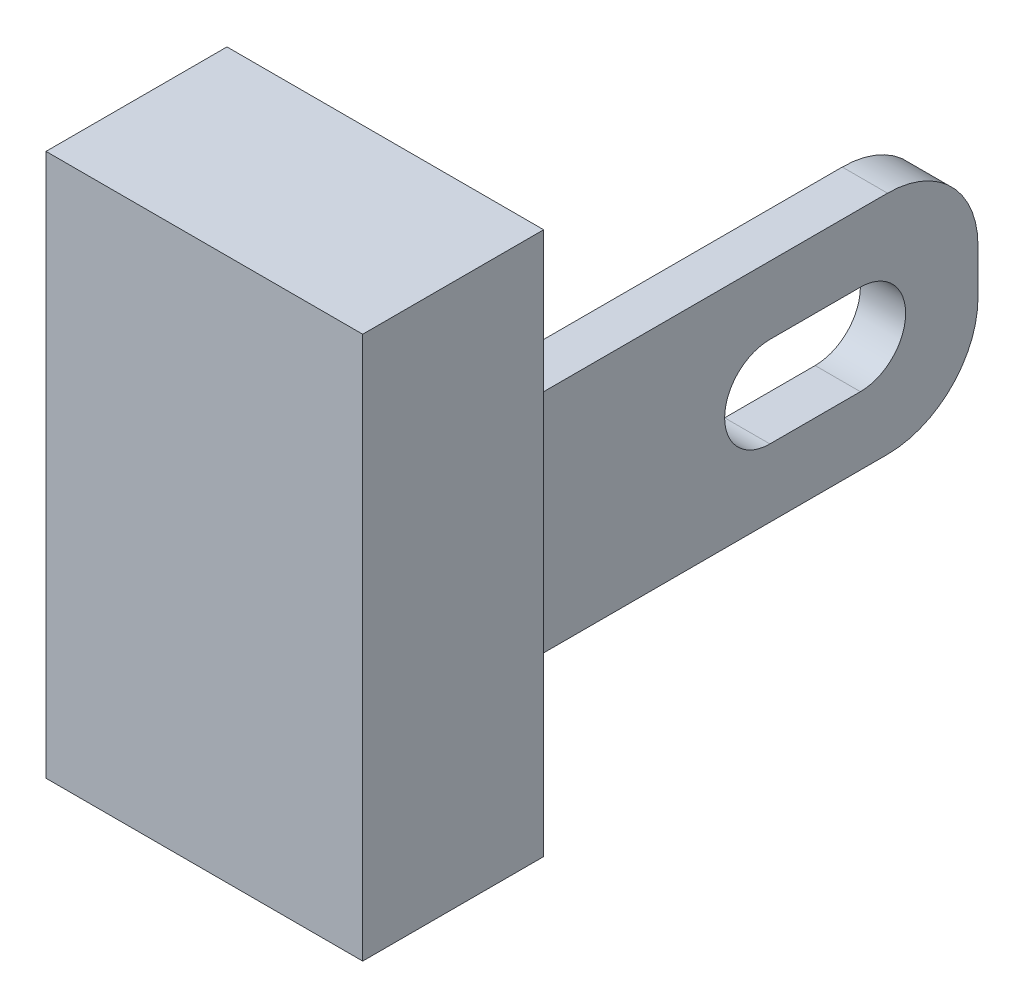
SolidWorks part; units mm, degrees
ref_plane "Front Plane" through (0, 0, 0) normal (0, 0, 1) x (1, 0, 0)
ref_plane "Top Plane" through (0, 0, 0) normal (0, 1, 0) x (1, 0, 0)
ref_plane "Right Plane" through (0, 0, 0) normal (1, 0, 0) x (0, 0, -1)
sketch "Sketch1" plane through (0, 0, 0) normal (0, 0, 1) x (1, 0, 0)
  line L1 (1.75, -3) -> (-1.75, -3)
  line L2 (1.75, -3) -> (1.75, 3)
  line L3 (1.75, 3) -> (-1.75, 3)
  line L4 (-1.75, -3) -> (-1.75, 3)
  line L5 (1.75, -3) -> (-1.75, 3) construction
  line L6 (1.75, 3) -> (-1.75, -3) construction
  point P0 (0, 0)
  dimension "D1" = 6
  dimension "D2" = 3.5
extrude "Boss-Extrude1" add sketch "Sketch1" along normal blind 2
sketch "Sketch2" plane through (0, 0, 0) normal (0, 0, -1) x (-1, 0, 0)
  line L0 (-1.75, -3) -> (-1.75, 3) construction
  line L1 (-1.55, -1.25) -> (-1.05, -1.25)
  line L2 (-1.55, -1.25) -> (-1.55, 1.25)
  line L3 (-1.55, 1.25) -> (-1.05, 1.25)
  line L4 (-1.05, -1.25) -> (-1.05, 1.25)
  line L5 (-1.55, -1.25) -> (-1.05, 1.25) construction
  line L6 (-1.55, 1.25) -> (-1.05, -1.25) construction
  point P0 (-1.3, 0)
  point P7 (0, 0)
  dimension "D1" = 0.2
  dimension "D2" = 0.5
  dimension "D3" = 2.5
extrude "Boss-Extrude2" add sketch "Sketch2" along normal blind 5
fillet "Fillet1" radius 1 2 edges at (1.3, -1.25, -5) (1.3, 1.25, -5)
sketch "Sketch3" plane through (1.55, 0, 0) normal (1, 0, 0) x (0, 0, -1)
  line L0 (2.7, 0) -> (3.7, 0) construction
  line L1 (2.7, 0.5) -> (3.7, 0.5)
  line L2 (2.7, -0.5) -> (3.7, -0.5)
  line L3 (5, 0.25) -> (5, -0.25) construction
  arc A0 (2.7, 0.5) -> (2.7, -0.5) centre (2.7, 0) ccw
  arc A1 (3.7, -0.5) -> (3.7, 0.5) centre (3.7, 0) ccw
  point P3 (3.2, 0)
  dimension "D1" = 0.5
  dimension "D3" = 1.3
  dimension "D2" = 1
extrude "Cut-Extrude1" cut sketch "Sketch3" against normal blind 5
